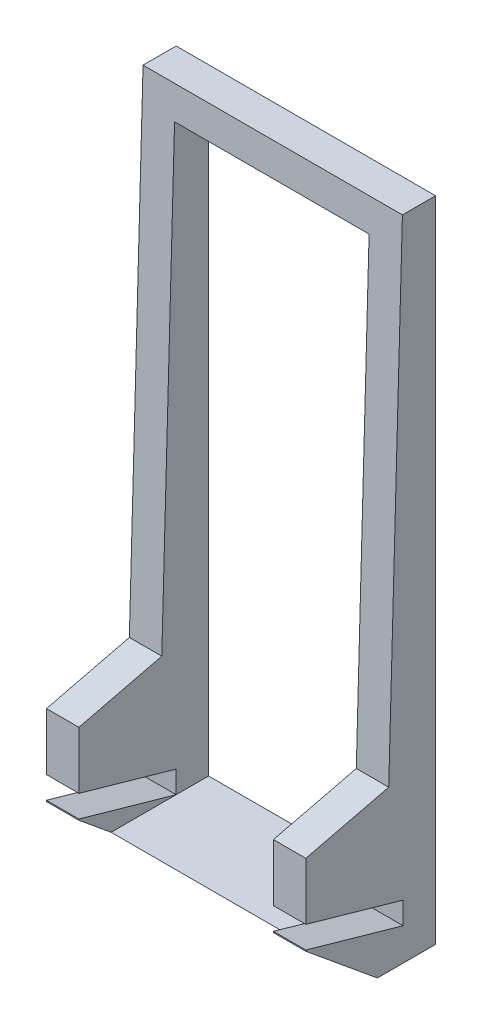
SolidWorks part; units mm, degrees
ref_plane "Plan de face" through (0, 0, 0) normal (0, 0, 1) x (1, 0, 0)
ref_plane "Plan de dessus" through (0, 0, 0) normal (0, 1, 0) x (1, 0, 0)
ref_plane "Plan de droite" through (0, 0, 0) normal (1, 0, 0) x (0, 0, -1)
sketch "Esquisse1" plane through (0, 0, 0) normal (0, 0, 1) x (1, 0, 0)
  line L0 (-32.6701, 5) -> (-2.6701, 5)
  line L1 (-37.6701, 0) -> (2.3299, 0)
  line L2 (-37.6701, 0) -> (-37.6701, 100)
  line L3 (-37.6701, 100) -> (2.3299, 100)
  line L4 (2.3299, 0) -> (2.3299, 100)
  line L5 (-2.6701, 5) -> (-2.6701, 95)
  line L6 (-32.6701, 95) -> (-2.6701, 95)
  line L7 (-32.6701, 5) -> (-32.6701, 95)
  dimension "D1" = 40
  dimension "D2" = 100
  dimension "D3" = 5
extrude "Boss.-Extru.1" add sketch "Esquisse1" along normal blind 20
sketch "Esquisse2" plane through (2.3299, 0, 0) normal (1, 0, 0) x (0, 0, -1)
  line L0 (-20, 9.2539) -> (-5, 5)
  line L1 (-20, 0) -> (-20, 100) construction
  line L2 (-5, 5) -> (-5, 8.4301)
  line L3 (-5, 8.4301) -> (-20, 12.684)
  line L4 (-20, 12.684) -> (-20, 9.2539)
  line L5 (-20, 5) -> (0, 5) construction
  point P6 (-2, 5)
  point P9 (-10, 11.3527)
  point P10 (-20, 16.1818)
  point P11 (-20, 9.2539)
  dimension "D1" = 3.3
  dimension "D2" = 15
extrude "Enlèv. mat.-Extru.1" cut sketch "Esquisse2" against normal through all
sketch "Esquisse3" plane through (2.3299, 0, 0) normal (1, 0, 0) x (0, 0, -1)
  line L0 (-20, 21.5067) -> (-7.2192, 24.613)
  line L1 (-20, 12.684) -> (-20, 100) construction
  line L2 (-7.2192, 24.613) -> (-5.1069, 100)
  line L3 (-20, 100) -> (0, 100) construction
  line L4 (-5.1069, 100) -> (-20, 100)
  line L5 (-20, 100) -> (-20, 21.5067)
  line L6 (-20, 9.0817) -> (-8.9587, 0)
  line L7 (-20, 0) -> (-20, 9.2539) construction
  line L8 (-20, 0) -> (0, 0) construction
  line L9 (-8.9587, 0) -> (-20, 0)
  line L10 (-20, 0) -> (-20, 9.0817)
extrude "Enlèv. mat.-Extru.2" cut sketch "Esquisse3" against normal through all
